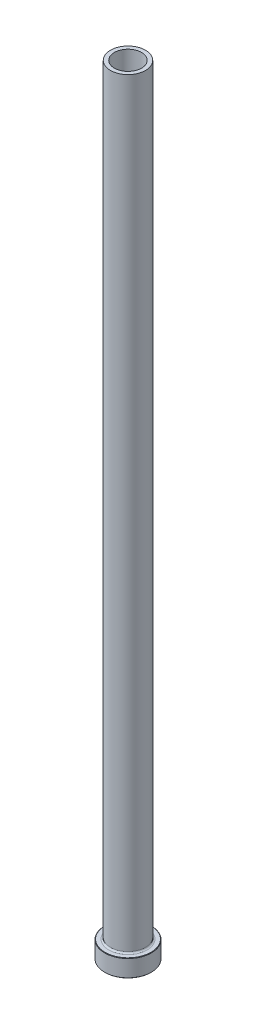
SolidWorks part; units mm, degrees
ref_plane "Front Plane" through (0, 0, 0) normal (0, 0, 1) x (1, 0, 0)
ref_plane "Top Plane" through (0, 0, 0) normal (0, 1, 0) x (1, 0, 0)
ref_plane "Right Plane" through (0, 0, 0) normal (1, 0, 0) x (0, 0, -1)
sketch "Sketch1" plane through (0, 0, 0) normal (0, 0, 1) x (1, 0, 0)
  line L0 (-7, 400) -> (-9, 400)
  line L1 (-9, 400) -> (-9, 9)
  line L2 (-9, 9) -> (-12, 9)
  line L3 (-12, 9) -> (-12, 0)
  line L4 (13.2, 0) -> (-13.2, 0) construction
  line L5 (-12, 0) -> (-7.25, 0)
  line L6 (-7, 345) -> (-7, 400)
  line L7 (0, 92.1877) -> (0, -15.5353) construction
  line L8 (0, -13.2) -> (0, 13.2) construction
  line L9 (-7, 345) -> (-7.25, 333)
  line L10 (-7.25, 333) -> (-7.25, 0)
  dimension "D1" = 0.25
  dimension "ID" = 14
  dimension "OD" = 18
  dimension "L" = 400
  dimension "H" = 24
  dimension "T" = 9
  dimension "N" = 55
  dimension "D2" = 12
revolve "Revolve1" add sketch "Sketch1" angle 360 about L7
fillet "Fillet1" radius 0.8 1 edges at (0, 9, 9)
chamfer "Chamfer1" distance 0.2 angle 45 2 edges at (0, 9, 12) (0, 0, 12)
chamfer "Chamfer3" distance 0.5 angle 45 1 edges at (0, 0, 7.25)
